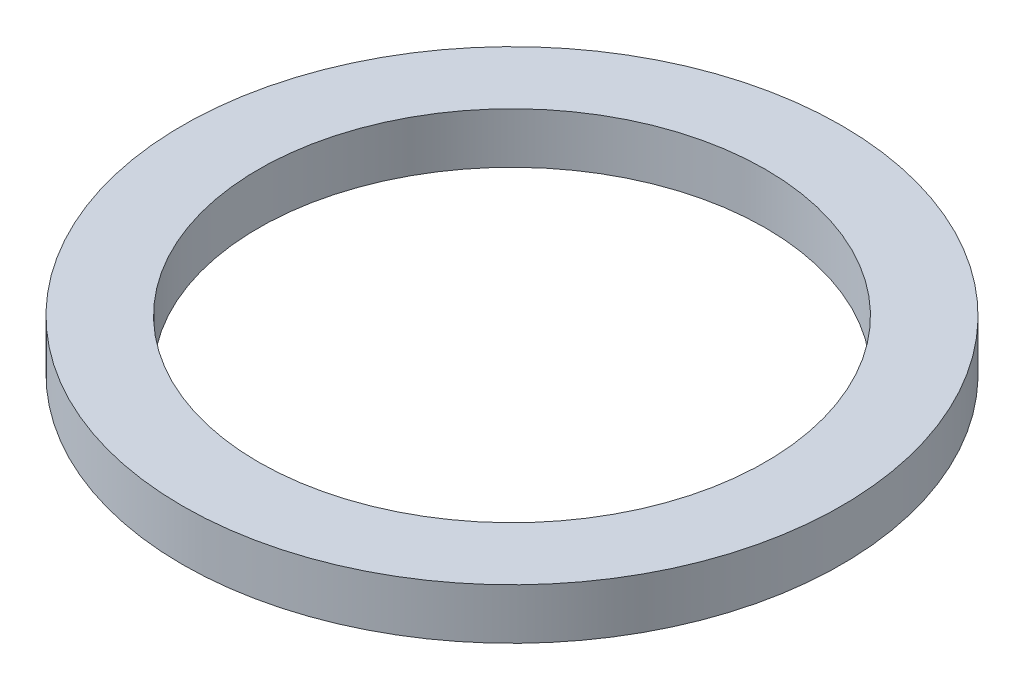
SolidWorks part; units mm, degrees
ref_plane "Plan1" through (0, 0, 0) normal (0, 0, 1) x (1, 0, 0)
ref_plane "Plan2" through (0, 0, 0) normal (0, 1, 0) x (1, 0, 0)
ref_plane "Plan3" through (0, 0, 0) normal (1, 0, 0) x (0, 0, -1)
sketch "Esquisse1" plane through (0, 0, 0) normal (0, 1, 0) x (1, 0, 0)
  circle A0 centre (0, 0) radius 5
  circle A1 centre (0, 0) radius 6.5
  dimension "D1" = 13
  dimension "D2" = 10
extrude "Base-Extrusion" add sketch "Esquisse1" along normal mid plane 1
